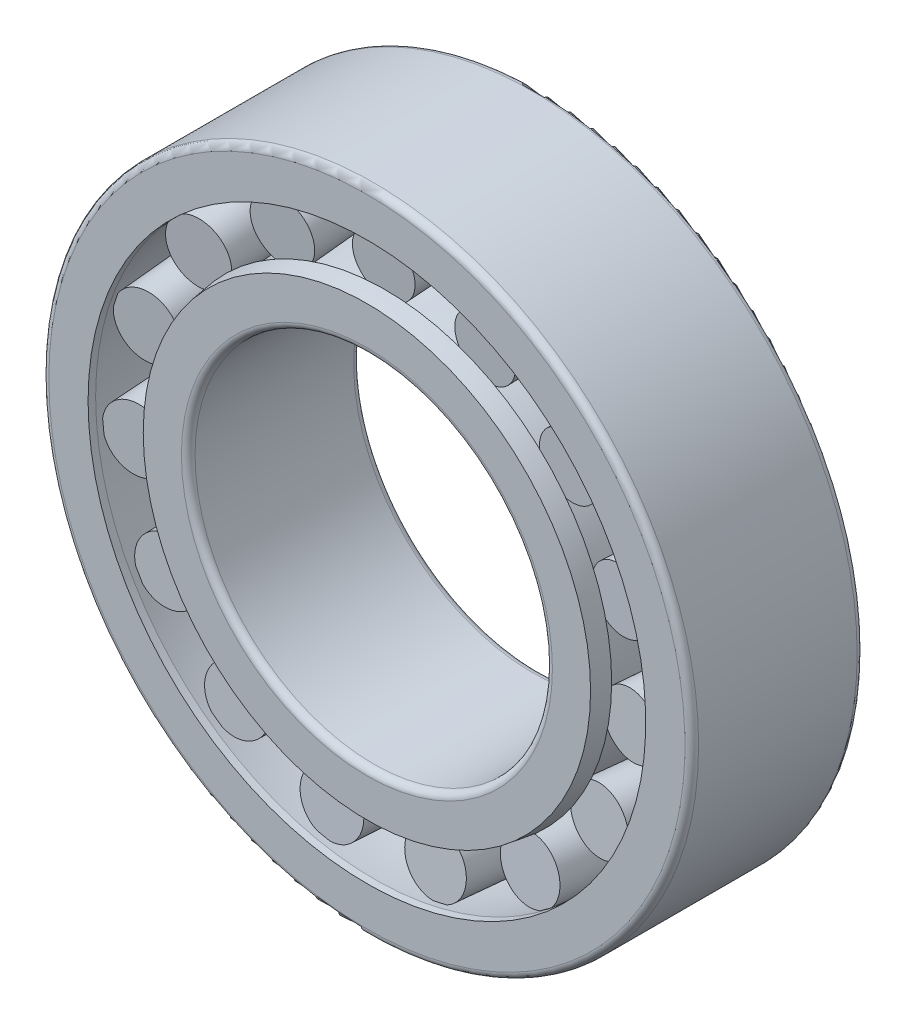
SolidWorks part; units mm, degrees
ref_plane "Front Plane" through (0, 0, 0) normal (0, 0, 1) x (1, 0, 0)
ref_plane "Top Plane" through (0, 0, 0) normal (0, 1, 0) x (1, 0, 0)
ref_plane "Right Plane" through (0, 0, 0) normal (1, 0, 0) x (0, 0, -1)
sketch "BaseSke" plane through (0, 0, 0) normal (1, 0, 0) x (0, 0, -1)
  line L0 (-47.2296, 0) -> (69.4868, 0) construction
  line L2 (0, 129.5214) -> (0, 87.4749) construction
  line L3 (-26.5, 55) -> (-26.5, 68.8462) construction
  line L4 (-26.5, 100) -> (26.5, 100) construction
  line L5 (-26.5, 55) -> (26.5, 55) construction
  line L7 (26.5, 55) -> (26.5, 68.8462) construction
  line L8 (26.5, 85.4615) -> (26.5, 100) construction
  line L9 (-26.5, 85.4615) -> (-26.5, 100) construction
  line L11 (0, 79.2725) -> (-26.5, 77.1538) construction
  line L12 (0, 79.2725) -> (26.5, 77.1538) construction
  line L13 (-26.5, 85.4615) -> (-26.5, 68.8462) construction
  line L14 (0, 71.07) -> (0, -86.3012) construction
  line L15 (0, 87.4749) -> (0, 71.07) construction
  line L16 (-21.3169, 76.6821) -> (-20.5504, 67.0951) construction
  line L17 (-22.0833, 86.269) -> (-4.4729, 87.677)
  line L18 (-22.0833, 86.269) -> (-21.3169, 76.6821)
  line L19 (-20.5504, 67.0951) -> (-2.9399, 68.503) construction
  line L20 (-4.4729, 87.677) -> (-3.7064, 78.09)
  line L21 (-2.9399, 68.503) -> (-3.7064, 78.09) construction
  line L22 (-21.3169, 76.6821) -> (-3.7064, 78.09)
  line L23 (-26.5, 76.2677) -> (0, 78.3863) construction
  arc A1 (-26.5, 85.4615) -> (26.5, 85.4615) centre (0, -87.93) cw construction
  arc A2 (26.5, 68.8462) -> (-26.5, 68.8462) centre (0, -87.93) ccw construction
  dimension "D2" = 13.8462
  dimension "D1" = 159
  dimension "Bearing_Thickness" = 53
  dimension "Bearing_Outside_Diameter" = 200
  dimension "Bearing_Inside_Diameter" = 110
  dimension "D3" = 14.5385
  dimension "D4" = 17.6667
  dimension "D5" = 4.4167
  dimension "D6" = 0.8833
revolve "Roller" add sketch "BaseSke" angle 360 about L23
sketch "OuterRaceSke" plane through (0, 0, 0) normal (1, 0, 0) x (0, 0, -1)
  line L0 (0, 0) -> (0, 94.5438) construction
  line L1 (-26.5, 100) -> (26.5, 100)
  line L2 (-26.5, 100) -> (-26.5, 85.4413)
  line L3 (26.5, 100) -> (26.5, 85.4413)
  line L5 (-50.3916, 0) -> (55.2197, 0) construction
  arc A0 (-26.5, 85.4413) -> (26.5, 85.4413) centre (0, -87.93) cw
  arc A2 (26.5, 85.4615) -> (-26.5, 85.4615) centre (0, -87.93) ccw construction
  dimension "D1" = 0.02
revolve "OuterRace" add sketch "OuterRaceSke" angle 360 about L5
sketch "InnerRaceSke" plane through (0, 0, 0) normal (1, 0, 0) x (0, 0, -1)
  line L0 (-70.8626, 0) -> (113.5527, 0) construction
  line L1 (0, 90.393) -> (0, -90.393) construction
  line L2 (-26.5, 55) -> (26.5, 55)
  line L3 (-26.5, 55) -> (-26.5, 68.8462)
  line L4 (-20.8587, 69.6959) -> (-20.6517, 67.1071)
  line L5 (-20.6517, 67.1071) -> (-2.8419, 68.5309)
  line L7 (-2.8419, 68.5309) -> (-3.0425, 71.0409)
  line L8 (-21.3169, 76.6821) -> (-20.5504, 67.0951) construction
  line L9 (2.8419, 68.5309) -> (3.0425, 71.0409)
  line L10 (-2.9399, 68.503) -> (-3.7064, 78.09) construction
  line L11 (-20.5504, 67.0951) -> (-2.9399, 68.503) construction
  line L14 (20.6517, 67.1071) -> (2.8419, 68.5309)
  line L15 (20.8587, 69.6959) -> (20.6517, 67.1071)
  line L16 (26.5, 55) -> (26.5, 68.8462)
  arc A0 (-26.5, 68.8462) -> (-20.8587, 69.6959) centre (0, -87.93) cw
  arc A1 (26.5, 68.8462) -> (-26.5, 68.8462) centre (0, -87.93) ccw construction
  arc A2 (-3.0425, 71.0409) -> (3.0425, 71.0409) centre (0, -87.93) cw
  arc A3 (26.5, 68.8462) -> (20.8587, 69.6959) centre (0, -87.93) ccw
  point P38 (0, 55)
  dimension "D2" = 0.1
  dimension "D1" = 0.02
  dimension "D3" = 0.1
revolve "InnerRace" add sketch "InnerRaceSke" angle 360 about L0
mirror "MirrorRoller" about plane through (0, 0, 0) normal (0, 0, 1) of "Roller"
fillet "Fillet1" radius 2.1 4 edges at (55, 0, 26.5) (100, 0, 26.5) (55, 0, -26.5) (100, 0, -26.5)
sketch "CutGrooveSke" plane through (0, 0, 0) normal (1, 0, 0) x (0, 0, -1)
  line L0 (-51.8407, 0) -> (83.8302, 0) construction
  line L1 (-13.25, -118) -> (-15.9, -118)
  line L2 (-13.25, -118) -> (-13.25, -98)
  line L3 (-13.25, -98) -> (-15.9, -98)
  line L4 (-15.9, -118) -> (-15.9, -98)
  dimension "D1" = 98
  dimension "D2" = 13.25
  dimension "D3" = 2.65
  dimension "D4" = 20
revolve "CutGroove" [suppressed] cut sketch "CutGrooveSke" angle 360 about L0
sketch "TaperSke" plane through (0, 0, 0) normal (1, 0, 0) x (0, 0, -1)
  line L0 (-26.5, 55) -> (26.5, 55)
  line L1 (26.5, 55) -> (26.5, 59.4167)
  line L2 (26.5, 59.4167) -> (-26.5, 55)
  line L7 (-41.2502, 0) -> (40.8606, 0) construction
  dimension "Taper" = 4.4167
revolve "Taper" [suppressed] cut sketch "TaperSke" angle 360 about L7
fillet "Fillet2" [suppressed] radius 2.1
pattern_circular "CirPatternBall" count 15 over 360 about axis through (0, 0, 0) along (0, 0, 1) of "Roller", "MirrorRoller"
sketch "SimplifiedSke" plane through (0, 0, 0) normal (1, 0, 0) x (0, 0, -1)
  line L0 (37.5911, 0) -> (-37.5911, 0) construction
  line L1 (0, 0) -> (0, 96.8272) construction
  line L2 (-20.5504, 67.0951) -> (-2.9399, 68.503)
  line L3 (-20.5504, 67.0951) -> (-22.0833, 86.269)
  line L4 (-22.0833, 86.269) -> (-4.4729, 87.677)
  line L5 (-2.9399, 68.503) -> (-4.4729, 87.677)
  line L7 (2.9399, 68.503) -> (4.4729, 87.677)
  line L8 (20.5504, 67.0951) -> (2.9399, 68.503)
  line L9 (20.5504, 67.0951) -> (22.0833, 86.269)
  line L10 (22.0833, 86.269) -> (4.4729, 87.677)
revolve "Simplified" [suppressed] add sketch "SimplifiedSke" angle 360 about L0
chamfer "Chamfer" distance 2.2083 angle 10 2 edges at (85.4413, 0, -26.5) (85.4413, 0, 26.5)
equation "\"D1@BaseSke\" = \"Bearing_Thickness@BaseSke\"*3"
equation "\"D2@BaseSke\" =  ( \"Bearing_Outside_Diameter@BaseSke\" - \"Bearing_Inside_Diameter@BaseSke\" ) /6.5"
equation "\"D3@BaseSke\" = \"D2@BaseSke\"*1.05"
equation "\"D4@BaseSke\" = \"Bearing_Thickness@BaseSke\"/3"
equation "\"D5@BaseSke\" = \"Bearing_Thickness@BaseSke\"/12"
equation "\"D6@BaseSke\" = \"Bearing_Thickness@BaseSke\"/60"
equation "\"D1@CutGrooveSke\" = \"Bearing_Outside_Diameter@BaseSke\" * 0.49"
equation "\"D2@CutGrooveSke\" = \"Bearing_Thickness@BaseSke\" *0.25"
equation "\"D3@CutGrooveSke\" = \"Bearing_Thickness@BaseSke\"/20"
equation "\"Taper@TaperSke\" = \"Bearing_Thickness@BaseSke\"/12"
equation "\"D1@Fillet2\" = \"Fillet_radius@Fillet1\""
equation "\"D1@CirPatternBall\" =  int(  ( \"Bearing_Outside_Diameter@BaseSke\" + \"Bearing_Inside_Diameter@BaseSke\" )  / 2 *  pi  /  ( \"Bearing_Outside_Diameter@BaseSke\" - \"Bearing_Inside_Diameter@BaseSke\" ) * 2.8 "
equation "\"D1@Chamfer\" = \"Bearing_Thickness@BaseSke\"/24"
